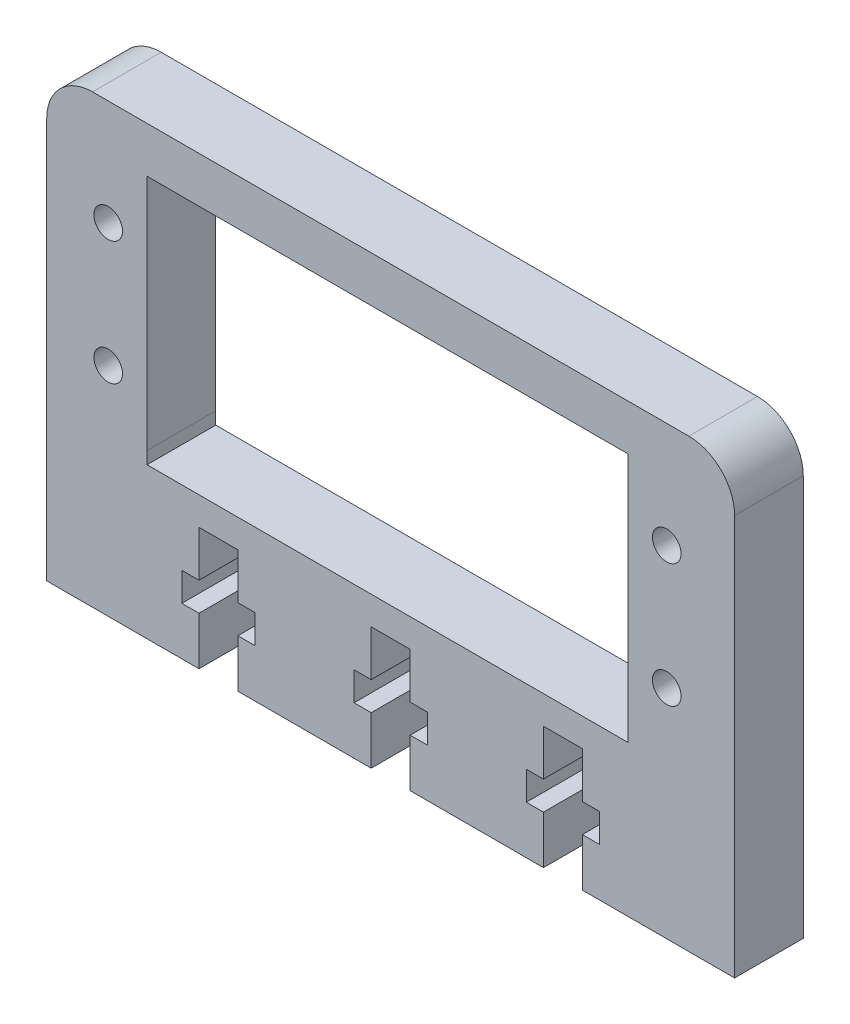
SolidWorks part; units mm, degrees
ref_plane "Front Plane" through (0, 0, 0) normal (0, 0, 1) x (1, 0, 0)
ref_plane "Top Plane" through (0, 0, 0) normal (0, 1, 0) x (1, 0, 0)
ref_plane "Right Plane" through (0, 0, 0) normal (1, 0, 0) x (0, 0, -1)
sketch "Sketch1" plane through (0, 0, 0) normal (0, 0, 1) x (1, 0, 0)
  line L0 (-22.0578, 38.2086) -> (-8.7578, 38.2086)
  line L1 (38.0398, 38.2086) -> (38.0398, 73.2086)
  line L2 (34.0398, 77.2086) -> (-18.0578, 77.2086)
  line L3 (-22.0578, 73.2086) -> (-22.0578, 38.2086)
  line L4 (7.991, 38.2086) -> (38.0398, 38.2086) construction
  line L5 (9.691, 38.2086) -> (9.691, 42.4086)
  line L6 (9.691, 42.4086) -> (11.191, 42.4086)
  line L7 (11.191, 42.4086) -> (11.191, 44.9086)
  line L8 (11.191, 44.9086) -> (9.691, 44.9086)
  line L9 (9.691, 44.9086) -> (9.691, 48.9086)
  line L10 (9.691, 48.9086) -> (6.291, 48.9086)
  line L11 (7.991, 38.2086) -> (7.991, 48.9086) construction
  line L12 (6.291, 38.2086) -> (6.291, 42.4086)
  line L13 (6.291, 42.4086) -> (4.791, 42.4086)
  line L14 (4.791, 42.4086) -> (4.791, 44.9086)
  line L15 (4.791, 44.9086) -> (6.291, 44.9086)
  line L16 (6.291, 44.9086) -> (6.291, 48.9086)
  line L17 (9.691, 38.2086) -> (21.3398, 38.2086)
  line L18 (38.0398, 38.2086) -> (23.0398, 38.2086) construction
  line L19 (23.0398, 38.2086) -> (23.0398, 48.9086) construction
  line L20 (-5.3578, 38.2086) -> (6.291, 38.2086)
  line L21 (24.7398, 38.2086) -> (24.7398, 42.4086)
  line L22 (24.7398, 42.4086) -> (26.2398, 42.4086)
  line L23 (26.2398, 42.4086) -> (26.2398, 44.9086)
  line L24 (26.2398, 44.9086) -> (24.7398, 44.9086)
  line L25 (24.7398, 44.9086) -> (24.7398, 48.9086)
  line L26 (24.7398, 48.9086) -> (21.3398, 48.9086)
  line L27 (21.3398, 38.2086) -> (21.3398, 42.4086)
  line L28 (21.3398, 42.4086) -> (19.8398, 42.4086)
  line L29 (19.8398, 42.4086) -> (19.8398, 44.9086)
  line L30 (19.8398, 44.9086) -> (21.3398, 44.9086)
  line L31 (21.3398, 44.9086) -> (21.3398, 48.9086)
  line L32 (-8.7578, 44.9086) -> (-8.7578, 48.9086)
  line L33 (-10.2578, 44.9086) -> (-8.7578, 44.9086)
  line L34 (-10.2578, 42.4086) -> (-10.2578, 44.9086)
  line L35 (-8.7578, 42.4086) -> (-10.2578, 42.4086)
  line L36 (-8.7578, 38.2086) -> (-8.7578, 42.4086)
  line L37 (-5.3578, 38.2086) -> (-5.3578, 42.4086)
  line L38 (-5.3578, 42.4086) -> (-3.8578, 42.4086)
  line L39 (-3.8578, 42.4086) -> (-3.8578, 44.9086)
  line L40 (-3.8578, 44.9086) -> (-5.3578, 44.9086)
  line L41 (-5.3578, 44.9086) -> (-5.3578, 48.9086)
  line L42 (-8.7578, 48.9086) -> (-5.3578, 48.9086)
  line L43 (24.7398, 38.2086) -> (38.0398, 38.2086)
  arc A0 (-22.0578, 73.2086) -> (-18.0578, 77.2086) centre (-18.0578, 73.2086) cw
  arc A1 (34.0398, 77.2086) -> (38.0398, 73.2086) centre (34.0398, 73.2086) cw
  dimension "D1" = 4
extrude "Boss-Extrude3" add sketch "Sketch1" against normal blind 6
sketch "Sketch2" plane through (0, 0, -6) normal (0, 0, -1) x (-1, 0, 0)
  line L0 (-28.7182, 77.2086) -> (-28.7182, 52.4552)
  line L1 (-34.0398, 77.2086) -> (18.0578, 77.2086) construction
  line L2 (-28.7182, 52.4552) -> (13.2957, 52.4552)
  line L3 (-7.7112, 52.4552) -> (-7.7112, 77.2086) construction
  line L4 (-28.7182, 77.2086) -> (13.2957, 77.2086)
  line L5 (13.2957, 77.2086) -> (13.2957, 52.4552)
  line L6 (-28.7182, 77.2086) -> (-28.7182, 52.4552)
  line L7 (13.2957, 52.4552) -> (13.2957, 77.2086)
  circle A0 centre (-32.1112, 67.9752) radius 2
  circle A1 centre (-32.1112, 57.1852) radius 2
  circle A2 centre (-32.1112, 57.1852) radius 1.25
  circle A3 centre (-32.1112, 67.9752) radius 1.25
  circle A4 centre (16.6888, 67.9752) radius 1.25
  circle A5 centre (16.6888, 57.1852) radius 1.25
extrude "Cut-Extrude1" cut sketch "Sketch2" against normal blind 6 contours L2 L3 L4 L0 | L3 L2 L5 M3 | A3 | A4 | A2 | A5
sketch "Sketch3" plane through (0, 0, -6) normal (0, 0, -1) x (-1, 0, 0)
  line L0 (-28.7182, 51.376) -> (-28.7182, 52.4552)
  line L2 (-28.7182, 51.376) -> (13.2949, 51.376)
  line L3 (13.2949, 51.376) -> (13.2957, 52.4552)
  line L4 (-28.7182, 52.4552) -> (13.2957, 52.4552)
extrude "Cut-Extrude3" cut sketch "Sketch3" against normal blind 6
sketch "Sketch4" plane through (0, 0, -6) normal (0, 0, -1) x (-1, 0, 0)
  line L0 (-28.7182, 77.2086) -> (13.2957, 77.2086)
  line L1 (-34.0398, 77.2086) -> (-28.7182, 77.2086) construction
  line L2 (13.2957, 77.2086) -> (18.0578, 77.2086) construction
  line L3 (13.2957, 77.2086) -> (13.2957, 73.2086)
  line L4 (13.2957, 77.2086) -> (13.2957, 52.4552) construction
  line L5 (13.2957, 73.2086) -> (-28.7182, 73.2086)
  line L6 (-28.7182, 77.2086) -> (-28.7182, 51.376) construction
  line L7 (-28.7182, 73.2086) -> (-28.7182, 77.2086)
extrude "Boss-Extrude4" add sketch "Sketch4" against normal blind 6
